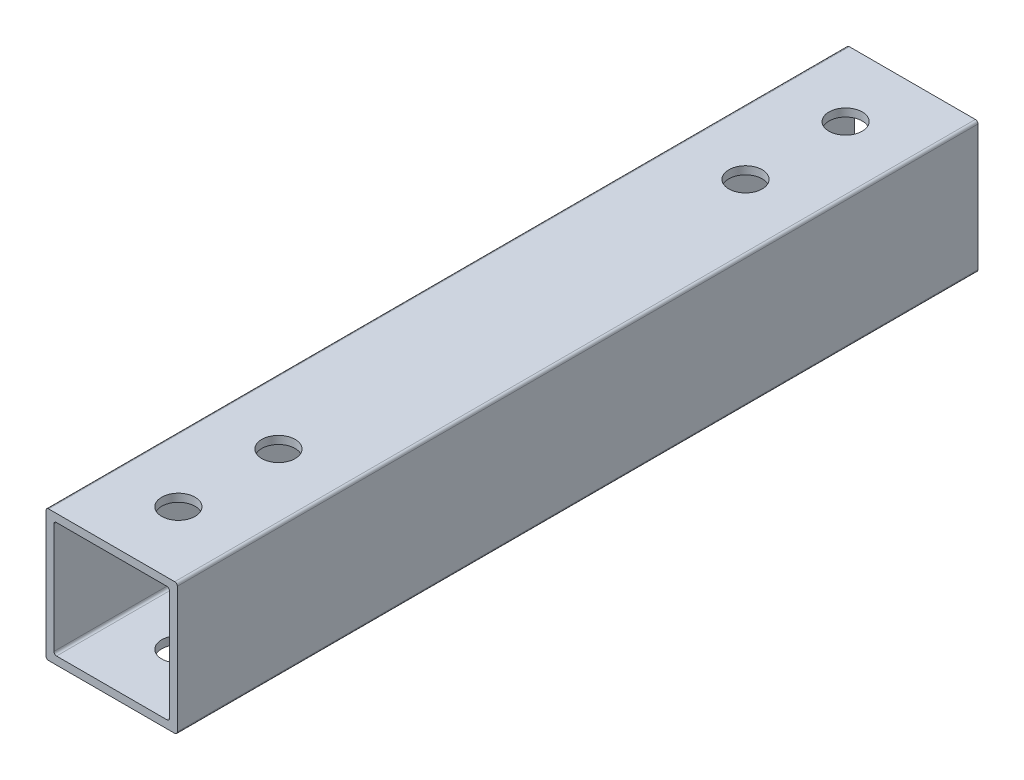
SolidWorks part; units mm, degrees
ref_plane "Front Plane" through (0, 0, 0) normal (0, 0, 1) x (1, 0, 0)
ref_plane "Top Plane" through (0, 0, 0) normal (0, 1, 0) x (1, 0, 0)
ref_plane "Right Plane" through (0, 0, 0) normal (1, 0, 0) x (0, 0, -1)
ref_plane "Plane1" through (0, 0, -2000) normal (0, 0, -1) x (-1, 0, 0)
sketch "Sketch1" plane through (0, 0, -2000) normal (0, 0, -1) x (-1, 0, 0)
  line L0 (11, 10.5) -> (11, -10.5)
  line L1 (10.5, -11) -> (-10.5, -11)
  line L2 (-11, -10.5) -> (-11, 10.5)
  line L3 (-10.5, 11) -> (10.5, 11)
  line L4 (12.5, -12) -> (12.5, 12)
  line L5 (12, 12.5) -> (-12, 12.5)
  line L6 (-12.5, 12) -> (-12.5, -12)
  line L7 (-12, -12.5) -> (12, -12.5)
  line L8 (0, 12.5) -> (0, -12.5) construction
  line L9 (-12.5, 0) -> (12.5, 0) construction
  arc A0 (11, -10.5) -> (10.5, -11) centre (10.5, -10.5) cw
  arc A1 (-10.5, -11) -> (-11, -10.5) centre (-10.5, -10.5) cw
  arc A2 (-11, 10.5) -> (-10.5, 11) centre (-10.5, 10.5) cw
  arc A3 (10.5, 11) -> (11, 10.5) centre (10.5, 10.5) cw
  arc A4 (12.5, 12) -> (12, 12.5) centre (12, 12) ccw
  arc A5 (-12, 12.5) -> (-12.5, 12) centre (-12, 12) ccw
  arc A6 (-12.5, -12) -> (-12, -12.5) centre (-12, -12) ccw
  arc A7 (12, -12.5) -> (12.5, -12) centre (12, -12) ccw
  dimension "D7" = 0.5
  dimension "D8" = 0.5
  dimension "D9" = 0.5
  dimension "D10" = 0.5
  dimension "D11" = 0.5
  dimension "D1" = 25
  dimension "D2" = 25
  dimension "D3" = 1.5
  dimension "D4" = 1.5
  dimension "D5" = 1.5
  dimension "D6" = 1.5
extrude "Boss-Extrude1" add sketch "Sketch1" against normal blind 152.4
sketch "Sketch2" plane through (0, 12.5, 0) normal (0, 1, 0) x (1, 0, 0)
  line L0 (0, 1847.6) -> (0, 2000) construction
  line L1 (-12, 1847.6) -> (12, 1847.6) construction
  line L2 (-12, 2000) -> (12, 2000) construction
  line L3 (-12, 1923.8) -> (12.5, 1923.8) construction
  line L6 (-12, 1847.6) -> (-12, 2000) construction
  line L7 (12.5, 1847.6) -> (12.5, 2000) construction
  circle A0 centre (0, 1860.3) radius 3.175
  circle A1 centre (0, 1879.35) radius 3.175
  circle A2 centre (0, 1987.3) radius 3.175
  circle A3 centre (0, 1968.25) radius 3.175
  dimension "D3" = 6.35
  dimension "D4" = 6.35
  dimension "D1" = 12.7
  dimension "D2" = 31.75
extrude "Cut-Extrude1" cut sketch "Sketch2" against normal up to surface (25 mm away)
